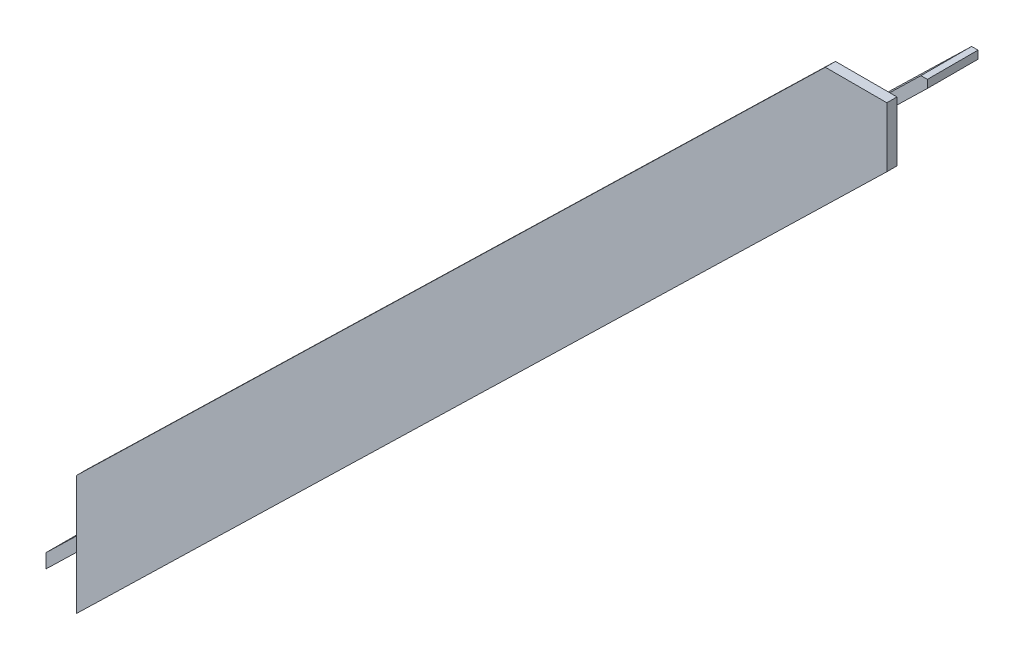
SolidWorks part; units mm, degrees
ref_plane "Plan de face" through (0, 0, 0) normal (0, 0, 1) x (1, 0, 0)
ref_plane "Plan de dessus" through (0, 0, 0) normal (0, 1, 0) x (1, 0, 0)
ref_plane "Plan de droite" through (0, 0, 0) normal (1, 0, 0) x (0, 0, -1)
ref_plane "Plan1" through (1042.5646, -1637.3363, 0) normal (-0.5371, 0.8435, 0) x (0.8435, 0.5371, 0)
sketch "Esquisse22" plane through (1042.5646, -1637.3363, 0) normal (-0.5371, 0.8435, 0) x (0.8435, 0.5371, 0)
  line L1 (1345.002, -920.31) -> (1345.002, -880.31)
sketch3d "Esquisse3D22"
  line L4 (2182.003, -768.641, 880.31) -> (2921.284, -50, 880.31)
  line L5 (2182.003, -886.692, 880.31) -> (2982.0039, -109.026, 880.31)
  line L6 (2982.0039, -109.026, 880.31) -> (2982.013, -49.992, 880.31)
  line L7 (2982.013, -49.992, 880.31) -> (2921.284, -50, 880.31)
  line L8 (2182.003, -886.692, 880.31) -> (2182.003, -768.641, 880.31)
extrude "Boss.-Extru.1" add sketch "Esquisse3D22" along direction (0, 0, -1) on the side of the normal blind 10
sketch "Esquisse23" plane through (0, 0, 870.31) normal (0, 0, -1) x (-1, 0, 0)
  line L0 (-3005.692, -20.004) -> (-3012.0001, -20.005)
  line L1 (-3012.0001, -20.005) -> (-3012.0032, -27.815)
  line L2 (-3012.0032, -27.815) -> (-2142.0081, -873.521)
  line L5 (-2142.0081, -873.521) -> (-2142.0031, -859.58)
  line L6 (-2142.0031, -859.58) -> (-3005.692, -20.004)
  point P4 (-3005.692, -21.6092)
extrude "Boss.-Extru.2" add sketch "Esquisse23" along a picked direction on the side of the normal blind 50
